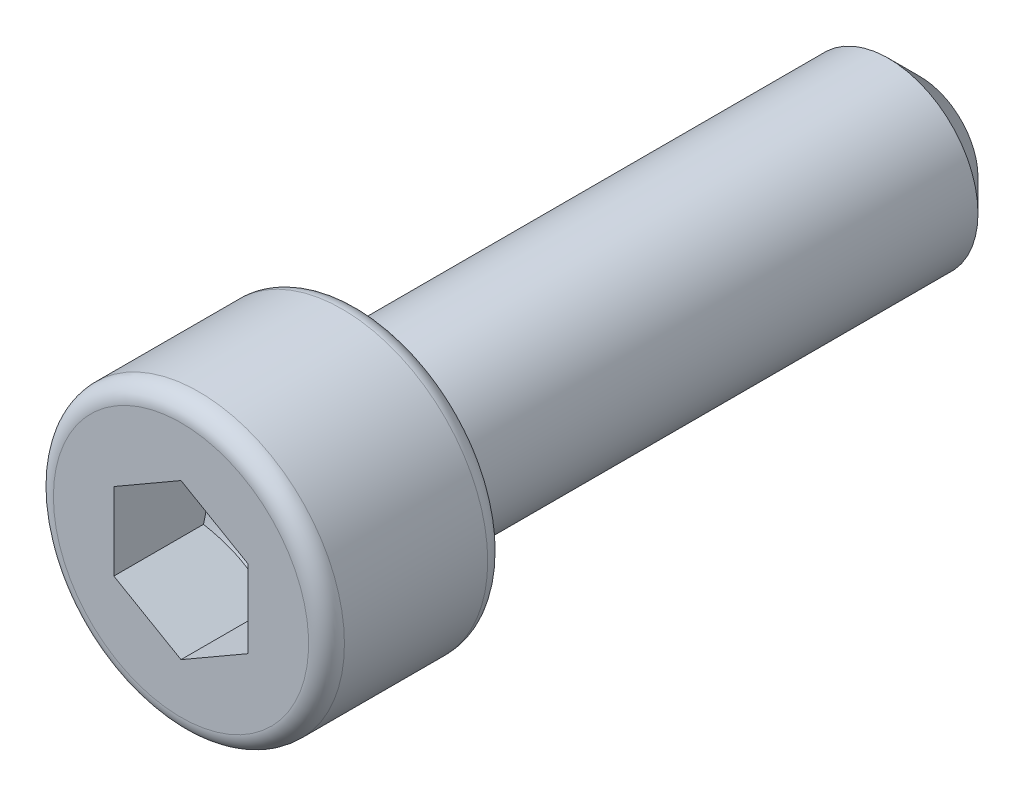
SolidWorks part; units mm, degrees
ref_plane "Спереди" through (0, 0, 0) normal (0, 0, 1) x (1, 0, 0)
ref_plane "Сверху" through (0, 0, 0) normal (0, 1, 0) x (1, 0, 0)
ref_plane "Справа" through (0, 0, 0) normal (1, 0, 0) x (0, 0, -1)
sketch "Sketch1" plane through (0, 0, 0) normal (1, 0, 0) x (0, 0, -1)
  line L0 (0, 0) -> (33, 0) construction
  line L1 (0, 0) -> (0, 6.5)
  line L2 (0, 6.5) -> (8, 6.5)
  line L3 (8, 6.5) -> (8, 4)
  line L4 (8, 4) -> (33, 4)
  line L5 (33, 4) -> (33, 0)
  line L6 (0, 0) -> (33, 0)
  line L7 (8, 4) -> (8, 0) construction
revolve "Revolve1" add sketch "Sketch1" angle 360 about L0
sketch "Sketch2" plane through (0, 0, 0) normal (0, 0, 1) x (1, 0, 0)
  line L1 (0, 3.4641) -> (-3, 1.7321)
  line L2 (-3, 1.7321) -> (-3, -1.7321)
  line L3 (-3, -1.7321) -> (0, -3.4641)
  line L4 (0, -3.4641) -> (3, -1.7321)
  line L5 (3, -1.7321) -> (3, 1.7321)
  line L6 (3, 1.7321) -> (0, 3.4641)
  circle A0 centre (0, 0) radius 3 construction
extrude "Hex" cut sketch "Sketch2" against normal blind 4
sketch "Sketch3" plane through (0, 0, -4) normal (0, 0, 1) x (1, 0, 0)
  line L1 (0, 3.4641) -> (-3, 1.7321)
  line L2 (-3, 1.7321) -> (-3, -1.7321)
  line L3 (-3, -1.7321) -> (0, -3.4641)
  line L4 (0, -3.4641) -> (3, -1.7321)
  line L5 (3, -1.7321) -> (3, 1.7321)
  line L6 (3, 1.7321) -> (0, 3.4641)
  circle A0 centre (0, 0) radius 3 construction
extrude "Cut-Extrude2" cut sketch "Sketch3" against normal blind 2.2192
sketch "Sketch4" plane through (0, 0, 0) normal (1, 0, 0) x (0, 0, -1)
  line L0 (0, 0) -> (33, 0) construction
  line L1 (33, -4) -> (33, 4) construction
  line L2 (6.2192, 0) -> (6.2192, 3.4671)
  line L3 (6.2192, 3.4671) -> (4, 3.4671)
  line L4 (4, 3.4671) -> (6.0017, 0)
  line L5 (6.0017, 0) -> (6.2192, 0)
  line L6 (0, 6.5) -> (0, -6.5) construction
revolve "Revolve2" add sketch "Sketch4" angle 360 about L0
fillet "FilletHead" radius 0.8 2 edges at (6.5, 0, -8) (6.5, 0, 0)
chamfer "ChamferRod" distance 1.4 angle 45 1 edges at (4, 0, -33)
sketch "Sketch5" plane through (0, 0, 0) normal (1, 0, 0) x (0, 0, -1)
  line L0 (8, 0) -> (8, 4) construction
  line L1 (8, 4) -> (31.6, 4)
  line L3 (0, 0) -> (8, 0) construction
  line L5 (8, 4) -> (8, 5.7)
surface "Surface-Revolve1" sketch "Sketch5" parameters "D1"=360
equation "\"D2@Sketch4\"= \"t@Hex\""
equation "\"D3@Sketch4\"= \"S@Sketch2\" * 1.1557"
equation "\"D4@Sketch4\"= \"t@Hex\" + \"D1@Cut-Extrude2\""
equation "\"D1@Cut-Extrude2\"= \"D3@Sketch4\" * tan ( 60 )"
equation "\"D1@Sketch3\"=\"S@Sketch2\""
equation "\"D1@Cosmetic Thread1\"=\"b@Sketch1\""
equation "\"D1@Sketch5\"= \"d1@Sketch1\""
equation "\"D2@Sketch5\"= \"k@Sketch1\""
equation "\"D3@Sketch5\"= \"L@Sketch1\" - \"c@ChamferRod\""
equation "\"D4@Sketch5\" = \"D@Sketch1\" - 2 * \"c2@FilletHead\""
